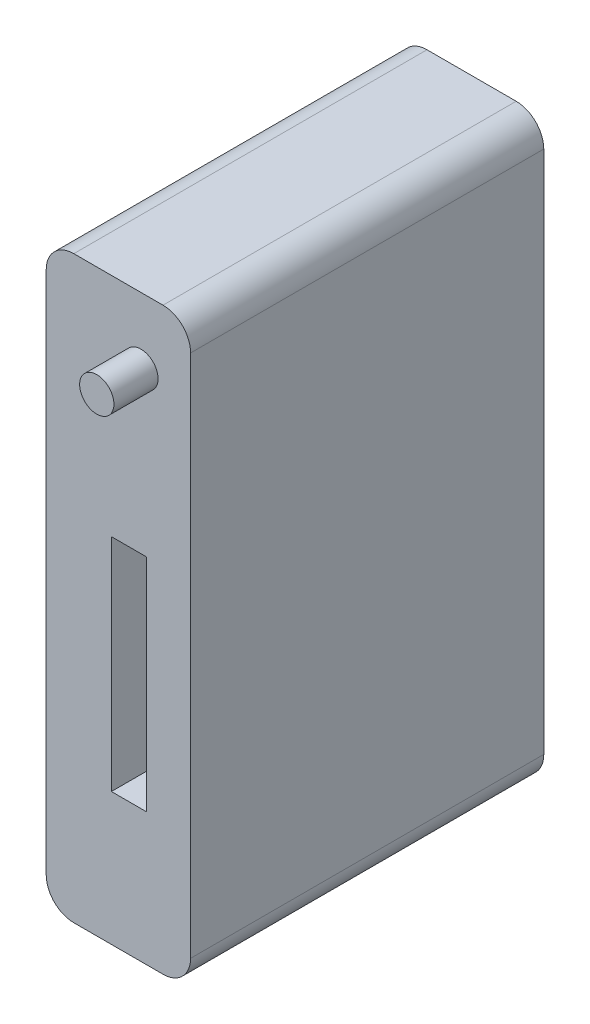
SolidWorks part; units mm, degrees
ref_plane "Front Plane" through (0, 0, 0) normal (0, 0, 1) x (1, 0, 0)
ref_plane "Top Plane" through (0, 0, 0) normal (0, 1, 0) x (1, 0, 0)
ref_plane "Right Plane" through (0, 0, 0) normal (1, 0, 0) x (0, 0, -1)
sketch "Sketch1" plane through (0, 0, 0) normal (0, 0, 1) x (1, 0, 0)
  line L1 (-8.081, -52.5) -> (8.081, -52.5)
  line L2 (-13.081, -47.5) -> (-13.081, 47.5)
  line L3 (-8.081, 52.5) -> (8.081, 52.5)
  line L4 (13.081, -47.5) -> (13.081, 47.5)
  line L5 (-13.081, -52.5) -> (13.081, 52.5) construction
  line L6 (-13.081, 52.5) -> (13.081, -52.5) construction
  arc A0 (-8.081, -52.5) -> (-13.081, -47.5) centre (-8.081, -47.5) cw
  arc A1 (8.081, -52.5) -> (13.081, -47.5) centre (8.081, -47.5) ccw
  arc A2 (8.081, 52.5) -> (13.081, 47.5) centre (8.081, 47.5) cw
  arc A3 (-13.081, 47.5) -> (-8.081, 52.5) centre (-8.081, 47.5) cw
  point P0 (0, 0)
  dimension "D3" = 5
  dimension "D1" = 26.162
  dimension "D2" = 105
extrude "Boss-Extrude1" add sketch "Sketch1" along normal mid plane 64
sketch "Sketch2" plane through (0, 0, 32) normal (0, 0, 1) x (1, 0, 0)
  line L0 (13.081, -47.5) -> (13.081, 47.5) construction
  line L1 (-1.269, -28.5) -> (5.081, -28.5)
  line L2 (-1.269, -28.5) -> (-1.269, 11.5)
  line L3 (-1.269, 11.5) -> (5.081, 11.5)
  line L4 (5.081, -28.5) -> (5.081, 11.5)
  line L5 (-8.081, -52.5) -> (8.081, -52.5) construction
  dimension "D1" = 6.35
  dimension "D2" = 40
  dimension "D3" = 8
  dimension "D4" = 24
extrude "Cut-Extrude1" cut sketch "Sketch2" against normal blind 7.62
sketch "Sketch3" plane through (0, 0, 32) normal (0, 0, 1) x (1, 0, 0)
  line L0 (8.081, 52.5) -> (-8.081, 52.5) construction
  line L1 (13.081, -47.5) -> (13.081, 47.5) construction
  circle A0 centre (4.081, 40.5) radius 3.105
  dimension "D1" = 6.21
  dimension "D2" = 12
  dimension "D3" = 9
extrude "Boss-Extrude2" add sketch "Sketch3" along normal blind 8
